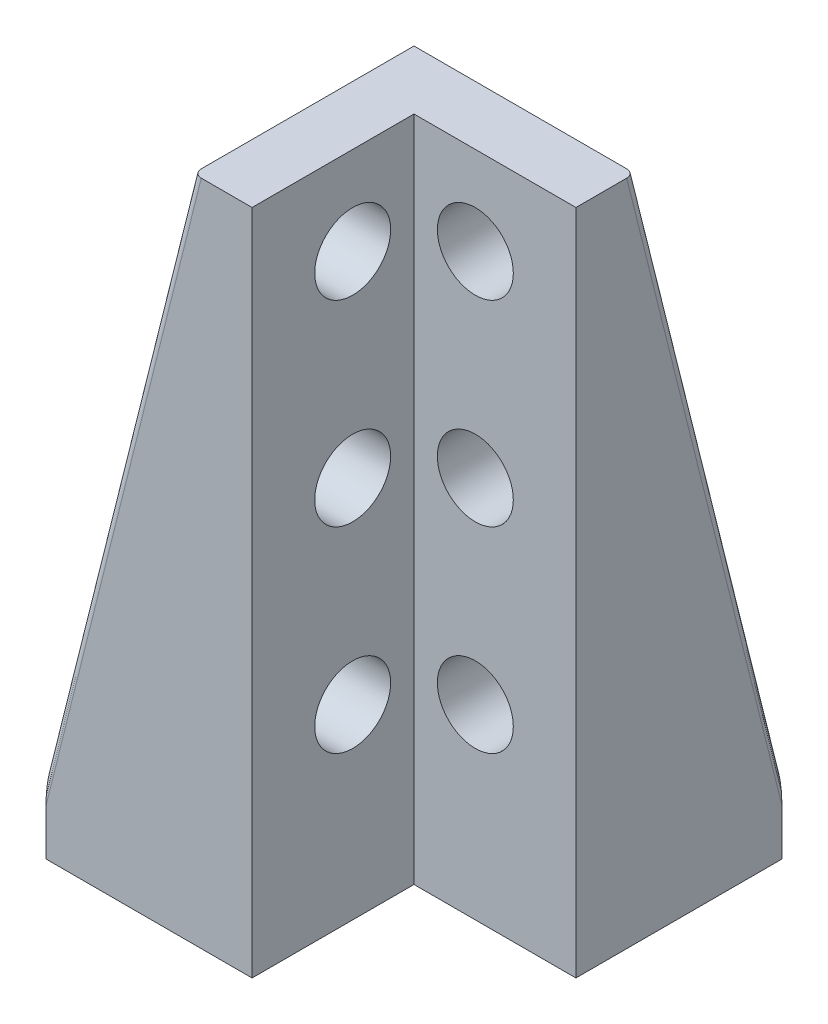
SolidWorks part; units mm, degrees
other "<chassisSideBracket>-<Fillet11>"
ref_plane "Front Plane" through (0, 0, 0) normal (0, 0, 1) x (1, 0, 0)
ref_plane "Top Plane" through (0, 0, 0) normal (0, 1, 0) x (1, 0, 0)
ref_plane "Right Plane" through (0, 0, 0) normal (1, 0, 0) x (0, 0, -1)
ref_plane "Front Plane-chassisSideBracket_Mirrored" through (0, 0, 0) normal (0, 0, -1) x (1, 0, 0)
ref_plane "Top Plane-chassisSideBracket_Mirrored" through (0, 0, 0) normal (0, 1, 0) x (1, 0, 0)
ref_plane "Right Plane-chassisSideBracket_Mirrored" through (0, 0, 0) normal (1, 0, 0) x (0, 0, 1)
mirrored part "chassisSideBracket_Mirrored" parameters "D1.Boss-Extrude1"=43.18, "D1.Sketch1"=3.81, "D2.Sketch1"=3.81, "D3.Sketch1"=7.9375, "D4.Sketch1"=7.9375, "D1.Boss-Extrude2"=5.08, "D2.Sketch2"=13.335, "D1.Sketch2"=13.335, "Thru Hole Dia..Sketch4"=4.3053, "Thru Hole Depth.Sketch4"=5.08, "C'Bore Dia..Sketch4"=8.7325, "C'Bore Depth.Sketch4"=3.4798, "D1.Sketch5"=5.08, "D2.Sketch5"=5.08, "D3.Sketch5"=8.5725, "D4.Sketch5"=8.5725, "D1.Boss-Extrude4"=2.54, "D1.Boss-Extrude5"=2.54, "D1.Fillet1"=3.175, "Thru Hole Dia..Sketch6"=4.9149, "Thru Hole Depth.Sketch6"=14.2875, "D1.Sketch7"=12.7, "D2.Sketch7"=12.7, "Thru Hole Dia..Sketch8"=4.9149, "Thru Hole Depth.Sketch8"=14.2875, "D1.Sketch9"=12.7, "D2.Sketch9"=12.7, "D1.Fillet10"=0.254, "D1.Fillet9"=0.508, "D1.Fillet11"=0.508
